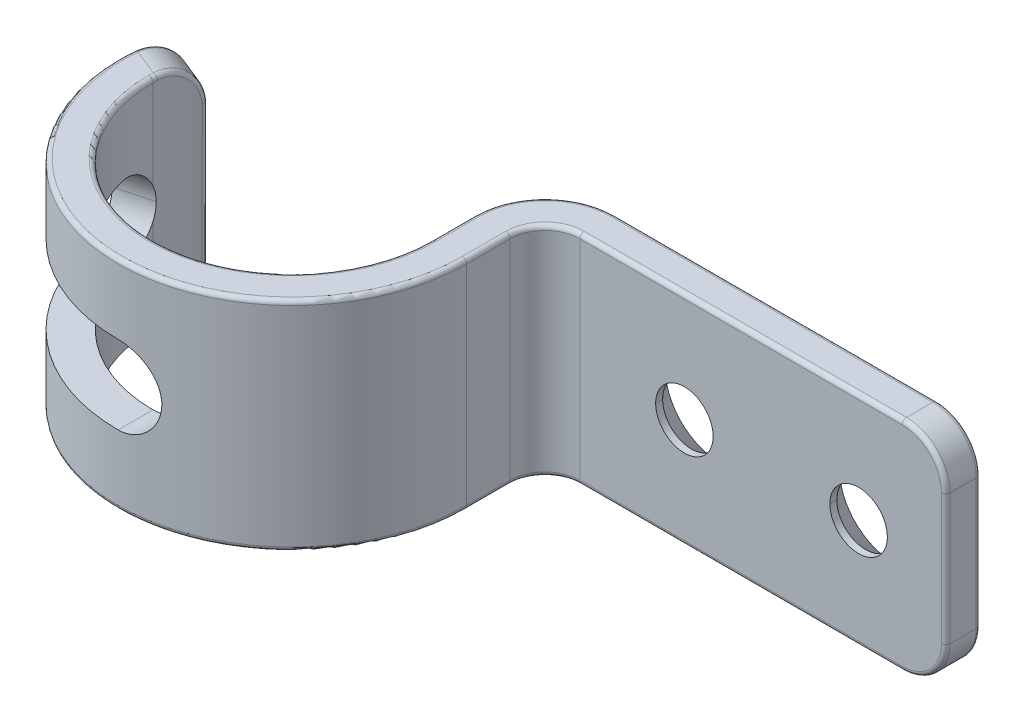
SolidWorks part; units mm, degrees
ref_plane "Front Plane" through (0, 0, 0) normal (0, 0, 1) x (1, 0, 0)
ref_plane "Top Plane" through (0, 0, 0) normal (0, 1, 0) x (1, 0, 0)
ref_plane "Right Plane" through (0, 0, 0) normal (1, 0, 0) x (0, 0, -1)
imported_body "1.3049 Kannatin kahvaprofiilille 32.STEP<1>"
fillet "Fillet1" radius 0.5
